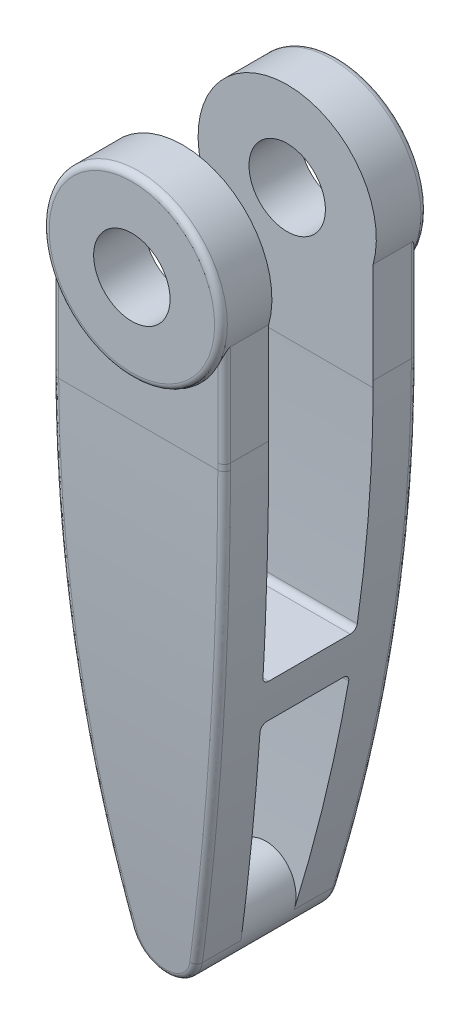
SolidWorks part; units mm, degrees
ref_plane "Спереди" through (0, 0, 0) normal (0, 0, 1) x (1, 0, 0)
ref_plane "Сверху" through (0, 0, 0) normal (0, 1, 0) x (1, 0, 0)
ref_plane "Справа" through (0, 0, 0) normal (1, 0, 0) x (0, 0, -1)
sketch "Эскиз1" plane through (0, 0, 0) normal (0, 0, 1) x (1, 0, 0)
  circle A1 centre (0, 0) radius 7
  dimension "D2" = 14
extrude "Бобышка-Вытянуть1" add sketch "Эскиз1" along normal blind 16.2
ref_plane "Плоскость1" through (0, 0, 8.1) normal (0, 0, 1) x (1, 0, 0)
sketch "Эскиз3" plane through (0, 0, 8.1) normal (0, 0, 1) x (1, 0, 0)
  line L0 (-6.75, 0) -> (6.75, 0)
  line L1 (6.75, 0) -> (6.75, -9.7594)
  line L2 (-6.75, 0) -> (-6.75, -9.7594)
  line L3 (0, 10.7524) -> (0, -12.7244) construction
  arc A0 (-2.5588, -46.8339) -> (2.5588, -46.8339) centre (0, -46.2479) ccw
  arc A1 (-6.75, -9.7594) -> (-2.5588, -46.8339) centre (159.32, -9.7594) ccw
  arc A2 (6.75, -9.7594) -> (2.5588, -46.8339) centre (-159.32, -9.7594) cw
  dimension "D3" = 5.25
  dimension "D4" = 332.14
  dimension "D1" = 46.2479
  dimension "D2" = 6.75
extrude "Бобышка-Вытянуть2" add sketch "Эскиз3" along normal mid plane 15.2 separate body
sketch "Эскиз4" plane through (0, 0, 0) normal (1, 0, 0) x (0, 0, -1)
  line L0 (-15.7, -9.7594) -> (-15.7, 0) construction
  line L1 (-15.7, -10.2474) -> (-15.7, 0)
  line L2 (-8.1, 7) -> (-8.1, -50.8908) construction
  line L3 (0, 7) -> (-16.2, 7) construction
  line L4 (-9.9566, -48.8729) -> (-13.48, -48.8729)
  line L5 (-15.7, -48.8729) -> (-0.5, -48.8729) construction
  line L6 (-15.7, 0) -> (-12.2, 0)
  line L7 (-12.2, -10.2474) -> (-12.2, -3.5) construction
  line L8 (-12.2, -10.2474) -> (-12.2, 0)
  line L9 (-15.7, 0) -> (-8.1, 0) construction
  line L10 (-8.1, -45.3729) -> (-10.3458, -45.3729) construction
  line L11 (-12.2, -3.5) -> (-8.1, -3.5) construction
  line L12 (-8.1, -48.8729) -> (-13.48, -48.8729) construction
  line L13 (-23.4696, -27) -> (8.2324, -27) construction
  line L14 (-11.7791, -27) -> (-4.4209, -27)
  line L15 (-11.6148, -30) -> (-4.5852, -30)
  line L16 (-0.5, 0) -> (-4, 0)
  line L17 (-0.5, -10.2474) -> (-0.5, 0)
  line L18 (-4, -10.2474) -> (-4, 0)
  line L19 (-6.2434, -48.8729) -> (-2.72, -48.8729)
  arc A0 (-15.7, -10.2474) -> (-13.48, -48.8729) centre (321.43, -10.2474) ccw
  arc A1 (-12.2, -10.2474) -> (-11.7791, -27) centre (321.43, -10.2474) ccw
  arc A2 (-12.2, -10.2474) -> (-10.3458, -45.3729) centre (321.43, -10.2474) ccw construction
  arc A3 (-11.6148, -30) -> (-9.9566, -48.8729) centre (321.43, -10.2474) ccw
  arc A4 (-4, -10.2474) -> (-4.4209, -27) centre (-337.63, -10.2474) cw
  arc A5 (-4.5852, -30) -> (-6.2434, -48.8729) centre (-337.63, -10.2474) cw
  arc A6 (-0.5, -10.2474) -> (-2.72, -48.8729) centre (-337.63, -10.2474) cw
  point P34 (-8.1, -27)
  point P35 (-8.1, -30)
  dimension "D1" = 674.26
  dimension "D2" = 5.38
  dimension "D4" = 3.5234
  dimension "D5" = 27
  dimension "D6" = 3
  dimension "D3" = 3.5
extrude "Вырез-Вытянуть1" cut sketch "Эскиз4" against normal mid plane 15.2 flip side to cut
sketch "Эскиз5" plane through (0, 0, 8.1) normal (0, 0, 1) x (1, 0, 0)
  circle A0 centre (0, -46.2479) radius 2.625
  arc A1 (-2.5588, -46.8339) -> (2.5588, -46.8339) centre (0, -46.2479) ccw construction
extrude "Бобышка-Вытянуть3" add sketch "Эскиз5" along normal mid plane 7
combine bodies "Соединить1" operation type add bodies to combine 106 101
sketch "Эскиз6" plane through (0, 0, 0) normal (0, 0, 1) x (1, 0, 0)
  circle A0 centre (0, 0) radius 3
  dimension "D1" = 6
extrude "Вырез-Вытянуть4" cut sketch "Эскиз6" along normal through all
fillet "Скругление1" radius 0.5 20 edges at (-6.75, -5.8067, 15.7) (-6.7498, -10.0034, 15.7) (0.0185, -48.8728, 13.48) (6.75, -5.8067, 15.7) (6.7498, -10.0034, 15.7) (-6.75, -5.8067, 0.5) (-6.7498, -10.0034, 0.5) (-0.0185, -48.8728, 2.72) (6.7498, -10.0034, 0.5) (0, -27, 4.4209) (0, -27, 11.7791) (0, -30, 4.5852) (0, -30, 11.6148) (6.75, -5.8067, 0.5) (7, 0, 0) (7, 0, 16.2)
sketch "Эскиз7" plane through (0, 0, 0) normal (1, 0, 0) x (0, 0, -1)
  line L0 (-4, -9.7594) -> (-4, -1.854) construction
  line L1 (-12.2, -7) -> (-4, -7)
  line L2 (-12.2, -7) -> (-12.2, 7)
  line L3 (-12.2, 7) -> (-4, 7)
  line L4 (-4, -7) -> (-4, 7)
  line L5 (-0.5, 7) -> (-15.7, 7) construction
  dimension "D1" = 8.2
extrude "Вырез-Вытянуть5" cut sketch "Эскиз7" against normal mid plane 20
